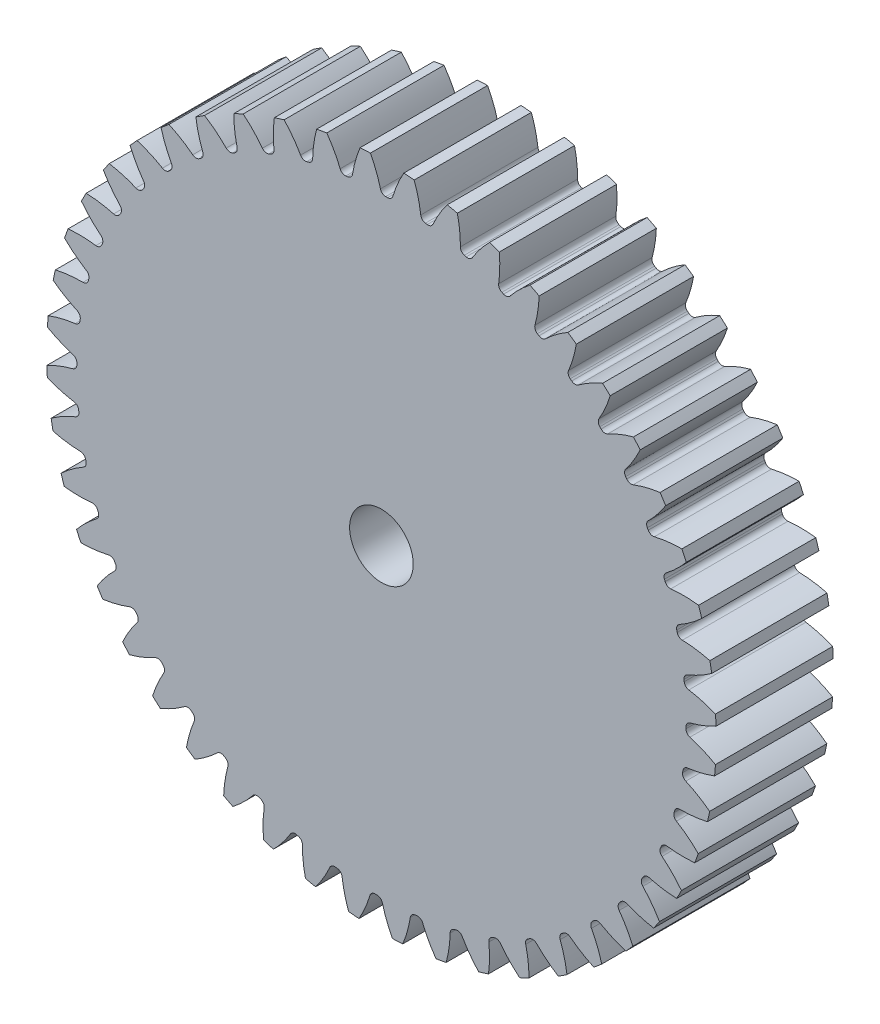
SolidWorks part; units mm, degrees
ref_plane "Front" through (0, 0, 0) normal (0, 0, 1) x (1, 0, 0)
ref_plane "Top" through (0, 0, 0) normal (0, 1, 0) x (1, 0, 0)
ref_plane "Right" through (0, 0, 0) normal (1, 0, 0) x (0, 0, -1)
sketch "Sketch3" plane through (0, 0, 0) normal (0, 0, 1) x (1, 0, 0)
  circle A0 centre (0, 0) radius 254
  dimension "od" = 508
extrude "gearBody" add sketch "Sketch3" along normal blind 88.9
sketch "Sketch2" plane through (0, 0, 0) normal (0, 0, 1) x (1, 0, 0)
  line L0 (0, 0) -> (211.6928, 87.686) construction
  line L1 (253.565, -17.0914) -> (0, 0) construction
  line L2 (0, 0) -> (36.3143, 0) construction
  line L3 (243.8105, 3.7954) -> (243.5397, -12.0983) construction
  line L5 (243.6751, -4.1515) -> (0, 0) construction
  line L7 (0, 0) -> (229.1346, 0) construction
  arc A0 (229.1342, -0.4331) -> (229.016, -7.3724) centre (0, 0) ccw construction
  arc A1 (253.862, 8.3706) -> (253.4296, -17.0133) centre (0, 0) ccw construction
  arc A2 (243.8105, 3.7954) -> (243.5397, -12.0983) centre (0, 0) ccw construction
  arc A3 (231.0931, -4.656) -> (231.1176, -3.2187) centre (0, 0) ccw
  arc A4 (253.565, -17.0914) -> (234.0548, -8.7047) centre (208.583, -94.8462) ccw
  arc A5 (253.565, -17.0914) -> (254, 8.4441) centre (0, 0) ccw
  arc A6 (254, 8.4441) -> (234.2155, 0.7268) centre (211.6928, 87.686) cw
  arc A7 (231.1176, -3.2187) -> (234.2155, 0.7268) centre (235.2523, -3.2762) cw
  arc A8 (234.0548, -8.7047) -> (231.0931, -4.656) centre (235.2274, -4.7393) cw
  point P6 (254, 8.4441)
  point P22 (253.565, -17.0914)
  dimension "baseDia" = 458.2693
  dimension "od" = 508
  dimension "pd" = 487.68
  dimension "rd" = 462.28
  dimension "rFillet" = 4.1351
  dimension "pointX" = 254
  dimension "pointY" = 8.4441
  dimension "CTT" = 15.8937
  dimension "flankCenterAngle" = 22.5
extrude "toothCut" cut sketch "Sketch2" along normal through all
pattern_circular "CirPattern1" count 48 over 360 about axis through (0, 0, 0) along (0, 0, 1) of "toothCut"
sketch "hub1Dia" plane through (0, 0, 0) normal (0, 0, -1) x (-1, 0, 0)
  circle A0 centre (0, 0) radius 12.7
  dimension "hub1Dia" = 25.4
sketch "hub2Dia" plane through (0, 0, 88.9) normal (0, 0, 1) x (1, 0, 0)
  circle A0 centre (0, 0) radius 12.7
  dimension "hub2dia" = 25.4
sketch "boreDia" plane through (0, 0, 0) normal (0, 0, 1) x (1, 0, 0)
  circle A0 centre (0, 0) radius 24.13
  dimension "boreDia" = 48.26
extrude "bore" cut sketch "boreDia" against normal mid plane 25400
